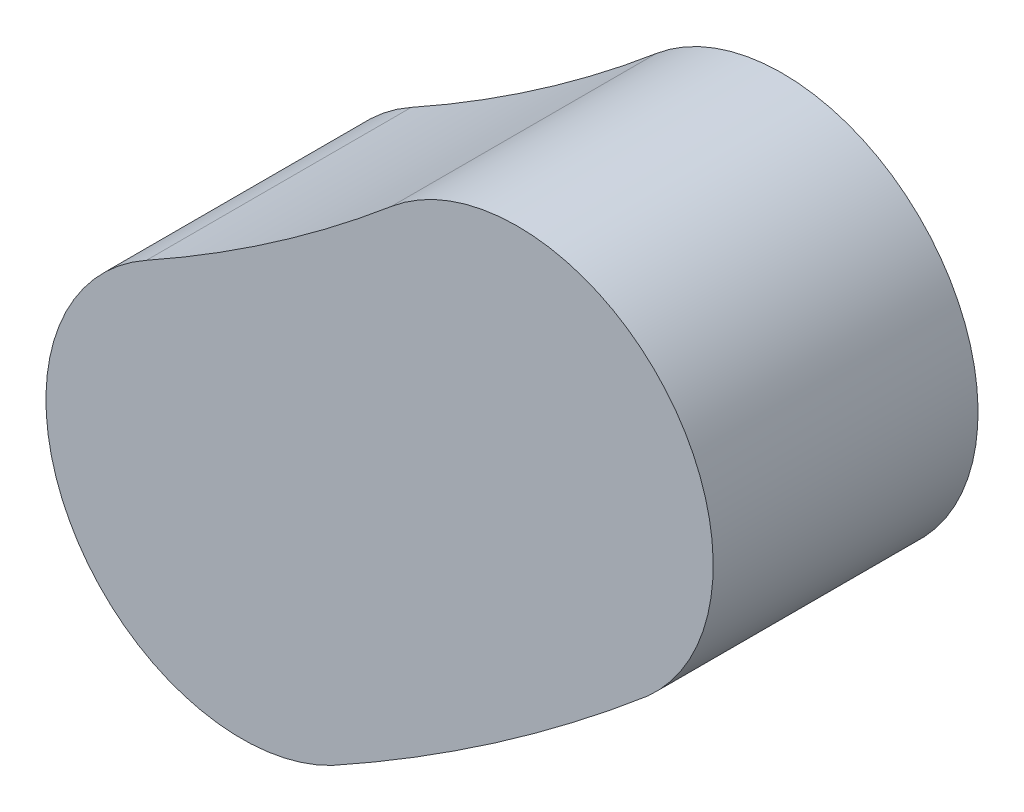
SolidWorks part; units mm, degrees
ref_plane "Front Plane" through (0, 0, 0) normal (0, 0, 1) x (1, 0, 0)
ref_plane "Top Plane" through (0, 0, 0) normal (0, 1, 0) x (1, 0, 0)
ref_plane "Right Plane" through (0, 0, 0) normal (1, 0, 0) x (0, 0, -1)
sketch "Sketch2" plane through (0, 0, 0) normal (0, 0, 1) x (1, 0, 0)
  line L0 (0, 90.8261) -> (25.6962, 44.7008) construction
  line L3 (0, 90.8261) -> (34.0252, 50.4513) construction
  arc A0 (22.8187, 49.8661) -> (28.4232, 39.4544) centre (25.6962, 44.7008) ccw
  arc A5 (28.4232, 39.4544) -> (37.9647, 46.0421) centre (0, 90.8261) ccw
  arc A7 (20.3779, 42.117) -> (36.7588, 52.9232) centre (0, 90.8261) ccw construction
  arc A9 (22.8187, 49.8661) -> (30.215, 54.9726) centre (0, 90.8261) ccw
  arc A10 (30.215, 54.9726) -> (37.7031, 45.8217) centre (34.0252, 50.4513) cw
  point P10 (0, 0)
  dimension "D1" = 52.8
  dimension "D5" = 11
extrude "Boss-Extrude1" add sketch "Sketch2" along normal blind 8 contours A10 A9 A0 A5
